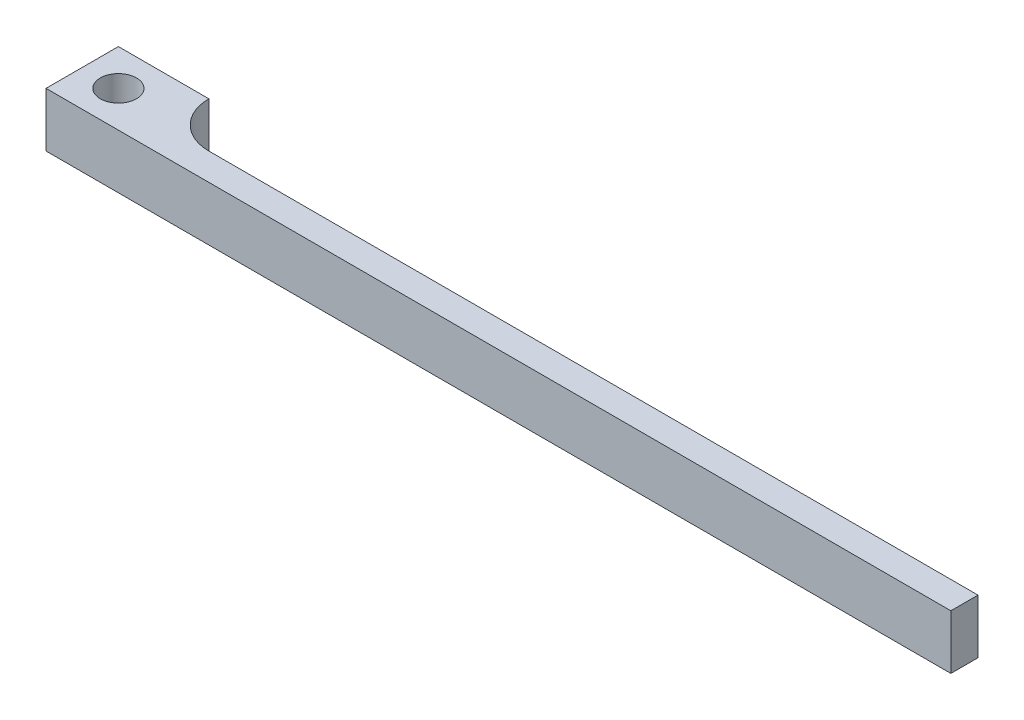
SolidWorks part; units mm, degrees
ref_plane "Front" through (0, 0, 0) normal (0, 0, 1) x (1, 0, 0)
ref_plane "Top" through (0, 0, 0) normal (0, 1, 0) x (1, 0, 0)
ref_plane "Right" through (0, 0, 0) normal (1, 0, 0) x (0, 0, -1)
sketch "Sketch1" plane through (0, 0, 0) normal (0, 0, 1) x (1, 0, 0)
  line L1 (0, 0) -> (100, 0)
  line L2 (0, 0) -> (0, 6)
  line L3 (0, 6) -> (100, 6)
  line L4 (100, 0) -> (100, 6)
  dimension "D1" = 100
  dimension "D2" = 6
extrude "Extrude1" add sketch "Sketch1" along normal blind 3
sketch "Sketch2" plane through (0, 0, 0) normal (0, 0, -1) x (-1, 0, 0)
  line L0 (-100, 6) -> (0, 6) construction
  line L1 (0, 0) -> (-10, 0)
  line L2 (0, 0) -> (0, 6)
  line L3 (0, 6) -> (-10, 6)
  line L4 (-10, 0) -> (-10, 6)
  dimension "D1" = 10
extrude "Extrude2" add sketch "Sketch2" along normal blind 5
fillet "Fillet1" radius 5 4 edges
sketch "Sketch3" plane through (0, 6, 0) normal (0, 1, 0) x (-1, 0, 0)
  line L0 (0, -5) -> (-10, -5) construction
  line L5 (0, 3) -> (0, -5) construction
  circle A0 centre (-4, -1) radius 2
  dimension "D1" = 4
  dimension "D3" = 4
  dimension "D2" = 4
extrude "Cut-Extrude1" cut sketch "Sketch3" against normal through all
